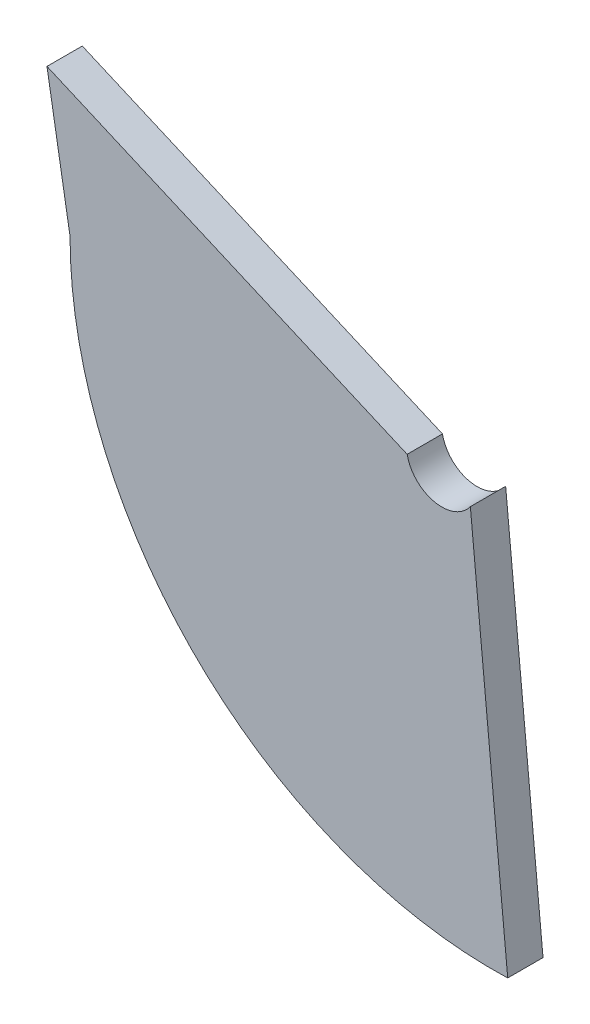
SolidWorks part; units mm, degrees
ref_plane "Front Plane" through (0, 0, 0) normal (0, 0, 1) x (1, 0, 0)
ref_plane "Top Plane" through (0, 0, 0) normal (0, 1, 0) x (1, 0, 0)
ref_plane "Right Plane" through (0, 0, 0) normal (1, 0, 0) x (0, 0, -1)
sketch "Sketch2" plane through (0, 0, 0) normal (0, 0, 1) x (1, 0, 0)
  line L0 (-42.7121, 344.8663) -> (216.4083, 232.7559)
  line L1 (-42.7121, 344.8663) -> (-26.1261, 247.2571)
  line L2 (236.288, 556.2409) -> (295.9288, -65.7462) construction
  line L4 (288.7471, -57.3764) -> (261.8759, 222.8606)
  arc A0 (216.4083, 232.7559) -> (261.8759, 222.8606) centre (241.3092, 237.7661) ccw
  arc A1 (-26.1261, 247.2571) -> (288.7471, -57.3764) centre (278.6739, 247.2571) ccw
  dimension "D1" = 50.8
  dimension "D2" = 304.8
  dimension "D3" = 6.35
extrude "Boss-Extrude1" add sketch "Sketch2" along normal blind 25.4
